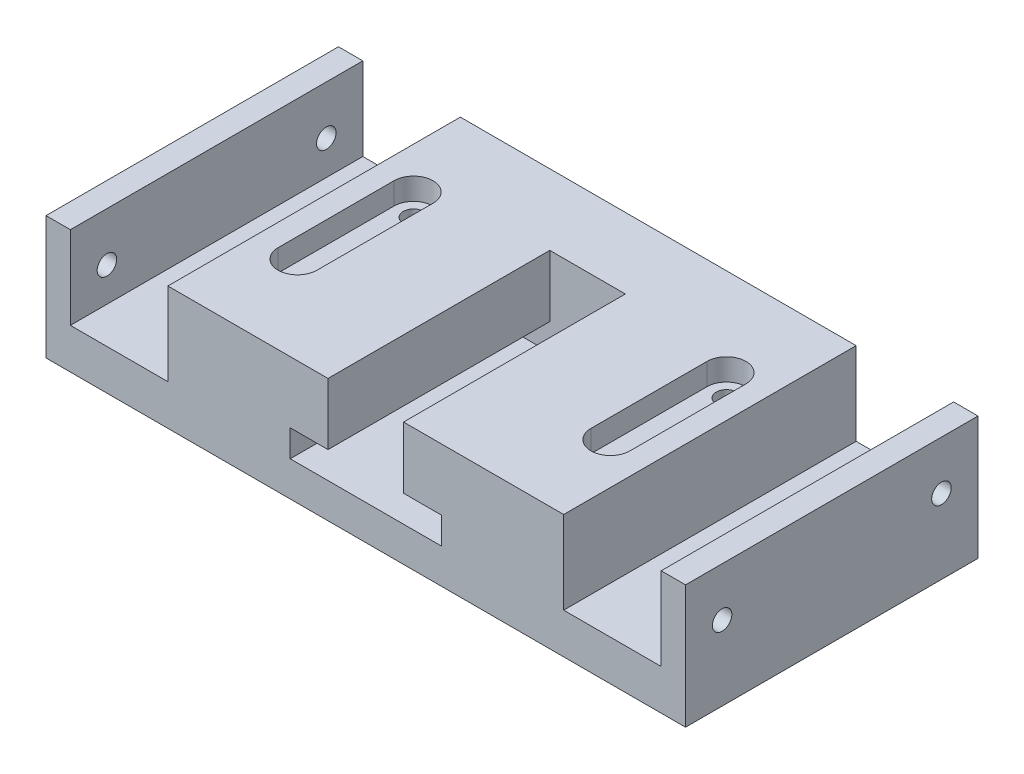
SolidWorks part; units mm, degrees
ref_plane "前基準面" through (0, 0, 0) normal (0, 0, 1) x (1, 0, 0)
ref_plane "上基準面" through (0, 0, 0) normal (0, 1, 0) x (1, 0, 0)
ref_plane "右基準面" through (0, 0, 0) normal (1, 0, 0) x (0, 0, -1)
sketch "草圖1" plane through (0, 0, 0) normal (0, 0, 1) x (1, 0, 0)
  line L1 (-65.6, 12.65) -> (65.6, 12.65)
  line L2 (-65.6, 12.65) -> (-65.6, -12.65)
  line L3 (-65.6, -12.65) -> (65.6, -12.65)
  line L4 (65.6, 12.65) -> (65.6, -12.65)
  line L5 (-65.6, 12.65) -> (65.6, -12.65) construction
  line L6 (-65.6, -12.65) -> (65.6, 12.65) construction
  point P0 (0, 0)
  dimension "D1" = 131.2
  dimension "D2" = 25.3
extrude "填料-伸長1" add sketch "草圖1" along normal blind 60
sketch "草圖4" plane through (0, 0, 60) normal (0, 0, 1) x (1, 0, 0)
  line L0 (0, -5.5) -> (0, -12.65) construction
  line L1 (65.6, 12.65) -> (-65.6, 12.65) construction
  line L2 (-65.6, -12.65) -> (65.6, -12.65) construction
  line L3 (7.75, 12.65) -> (-7.75, 12.65)
  line L4 (-7.75, 12.65) -> (-7.75, 0) construction
  line L5 (15.5, -5.5) -> (-15.5, -5.5)
  line L6 (-15.5, -5.5) -> (-15.5, 0)
  line L7 (-15.5, 0) -> (-7.75, 0)
  line L11 (-7.75, 12.65) -> (-7.75, 0)
  line L12 (15.5, -5.5) -> (15.5, 0)
  line L13 (15.5, 0) -> (7.75, 0)
  line L14 (7.75, 12.65) -> (7.75, 0)
  line L15 (0, 12.65) -> (0, -12.65) construction
  dimension "D1" = 12.65
  dimension "D2" = 7.75
  dimension "D4" = 5.5
  dimension "D5" = 15.5
extrude "除料-伸長1" cut sketch "草圖4" against normal blind 45.5
sketch "草圖5" plane through (0, 12.65, 0) normal (0, 1, 0) x (1, 0, 0)
  line L0 (0, 0) -> (0, -60) construction
  line L1 (-15.5, -60) -> (15.5, -60) construction
  line L3 (-65.6, -30) -> (65.6, -30) construction
  line L4 (-65.6, -60) -> (-65.6, 0) construction
  line L5 (65.6, -60) -> (65.6, 0) construction
  circle A0 centre (-32.1, -18.1) radius 2.1
  circle A1 centre (32.1, -18.1) radius 2.1
  circle A2 centre (-32.1, -41.9) radius 2.1
  circle A3 centre (32.1, -41.9) radius 2.1
  dimension "D1" = 4.2
  dimension "D3" = 11.9
  dimension "D2" = 32.1
extrude "除料-伸長2" cut sketch "草圖5" against normal blind 45.5
sketch "草圖6" plane through (0, 12.65, 0) normal (0, 1, 0) x (1, 0, 0)
  line L0 (-28.1, -41.9) -> (-28.1, -18.1)
  line L1 (-36.1, -18.1) -> (-36.1, -41.9)
  line L2 (0, 0) -> (0, -60) construction
  line L3 (-15.5, -60) -> (15.5, -60) construction
  line L4 (36.1, -18.1) -> (36.1, -41.9)
  line L5 (28.1, -41.9) -> (28.1, -18.1)
  arc A0 (-28.1, -18.1) -> (-36.1, -18.1) centre (-32.1, -18.1) ccw
  arc A1 (-36.1, -41.9) -> (-28.1, -41.9) centre (-32.1, -41.9) ccw
  arc A2 (28.1, -18.1) -> (36.1, -18.1) centre (32.1, -18.1) cw
  arc A3 (36.1, -41.9) -> (28.1, -41.9) centre (32.1, -41.9) cw
  dimension "D1" = 8
  dimension "D2" = 8
extrude "除料-伸長3" cut sketch "草圖6" against normal blind 4.5
sketch "草圖7" plane through (0, 0, 60) normal (0, 0, 1) x (1, 0, 0)
  line L0 (0, 12.65) -> (0, -12.65) construction
  line L1 (7.75, 12.65) -> (-7.75, 12.65) construction
  line L2 (-65.6, -12.65) -> (65.6, -12.65) construction
  line L17 (-60.6, 12.65) -> (-60.6, -4.35)
  line L18 (-7.75, 12.65) -> (-65.6, 12.65) construction
  line L19 (-60.6, -4.35) -> (-40.6, -4.35)
  line L20 (-40.6, -4.35) -> (-40.6, 12.65)
  line L21 (-40.6, 12.65) -> (-60.6, 12.65)
  line L22 (-65.6, 12.65) -> (-65.6, -12.65) construction
  line L23 (40.6, -4.35) -> (40.6, 12.65)
  line L24 (60.6, -4.35) -> (40.6, -4.35)
  line L25 (60.6, 12.65) -> (60.6, -4.35)
  line L26 (40.6, 12.65) -> (60.6, 12.65)
  dimension "D1" = 20
  dimension "D2" = 5
  dimension "D3" = 17
extrude "除料-伸長4" cut sketch "草圖7" against normal through all
sketch "草圖8" plane through (-65.6, 0, 0) normal (-1, 0, 0) x (0, 0, 1)
  line L0 (0, 12.65) -> (60, 12.65) construction
  line L4 (0, 12.65) -> (0, -12.65) construction
  line L5 (60, 12.65) -> (60, -12.65) construction
  line L6 (60, -12.65) -> (0, -12.65) construction
  line L7 (60, 2.65) -> (0, 2.65) construction
  line L8 (30, 12.65) -> (30, -12.65) construction
  circle A0 centre (52.5, 2.65) radius 2
  circle A1 centre (7.5, 2.65) radius 2
  dimension "D3" = 4
  dimension "D4" = 22.5
  dimension "D1" = 25.3
  dimension "D2" = 15.3
extrude "除料-伸長5" cut sketch "草圖8" against normal up to next
sketch "草圖9" plane through (65.6, 0, 0) normal (1, 0, 0) x (0, 0, -1)
  line L0 (0, 2.65) -> (-60, 2.65) construction
  line L1 (0, -12.65) -> (0, 12.65) construction
  line L2 (-60, -12.65) -> (-60, 12.65) construction
  line L3 (-60, -12.65) -> (0, -12.65) construction
  line L4 (-30, 12.65) -> (-30, -12.65) construction
  line L5 (-60, 12.65) -> (0, 12.65) construction
  circle A0 centre (-7.5, 2.65) radius 2
  circle A1 centre (-52.5, 2.65) radius 2
  dimension "D2" = 4
  dimension "D3" = 22.5
  dimension "D1" = 15.3
extrude "除料-伸長6" cut sketch "草圖9" against normal up to next
sketch "草圖10" plane through (0, -12.65, 0) normal (0, -1, 0) x (1, 0, 0)
  line L0 (-32.1, 18.1) -> (-32.1, 0) construction
  line L2 (-65.6, 30) -> (65.6, 30) construction
  line L3 (-65.6, 60) -> (-65.6, 0) construction
  line L4 (65.6, 60) -> (65.6, 0) construction
  line L5 (-65.6, 0) -> (65.6, 0) construction
  line L6 (0, 60) -> (0, 0) construction
  line L7 (-65.6, 60) -> (65.6, 60) construction
  circle A1 centre (-32.1, 10.6) radius 3.5
  circle A3 centre (32.1, 10.6) radius 3.5
  circle A5 centre (32.1, 18.1) radius 2.1 construction
  circle A6 centre (32.1, 49.4) radius 3.5
  circle A7 centre (-32.1, 47.9) radius 3.5
  circle A9 centre (-32.1, 41.9) radius 2.1 construction
  point P26 (0, 0)
  point P29 (0, 0)
  dimension "D1" = 7
  dimension "D3" = 7.5
  dimension "D4" = 7
  dimension "D2" = 7.5
  dimension "D5" = 6
extrude "除料-伸長7" cut sketch "草圖10" against normal blind 4
